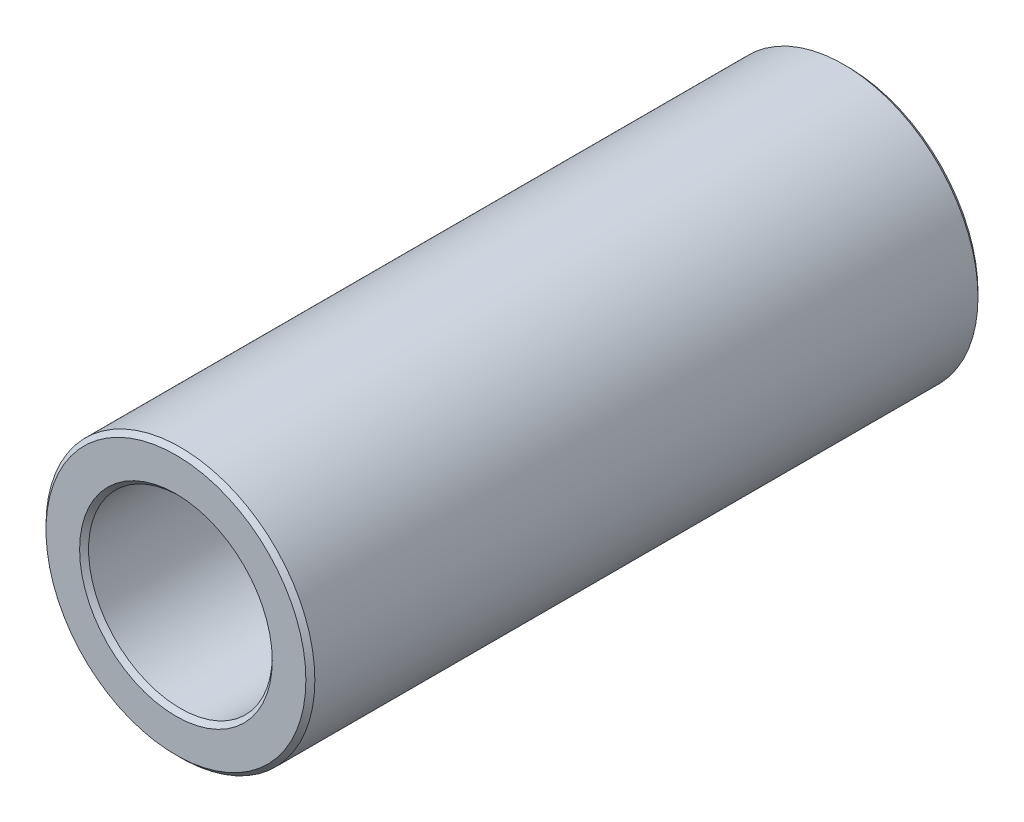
SolidWorks part; units mm, degrees
ref_plane "Front Plane" through (0, 0, 0) normal (0, 0, 1) x (1, 0, 0)
ref_plane "Top Plane" through (0, 0, 0) normal (0, 1, 0) x (1, 0, 0)
ref_plane "Right Plane" through (0, 0, 0) normal (1, 0, 0) x (0, 0, -1)
sketch "Sketch1" plane through (0, 0, 0) normal (0, 0, 1) x (1, 0, 0)
  circle A0 centre (0, 0) radius 6
  circle A1 centre (0, 0) radius 4.1
  dimension "D1" = 12
  dimension "D2" = 8.2
extrude "Boss-Extrude2" add sketch "Sketch1" along normal mid plane 30
chamfer "Chamfer3" distance 0.2 angle 45 4 edges at (6, 0, 15) (6, 0, -15) (4.1, 0, -15) (4.1, 0, 15)
